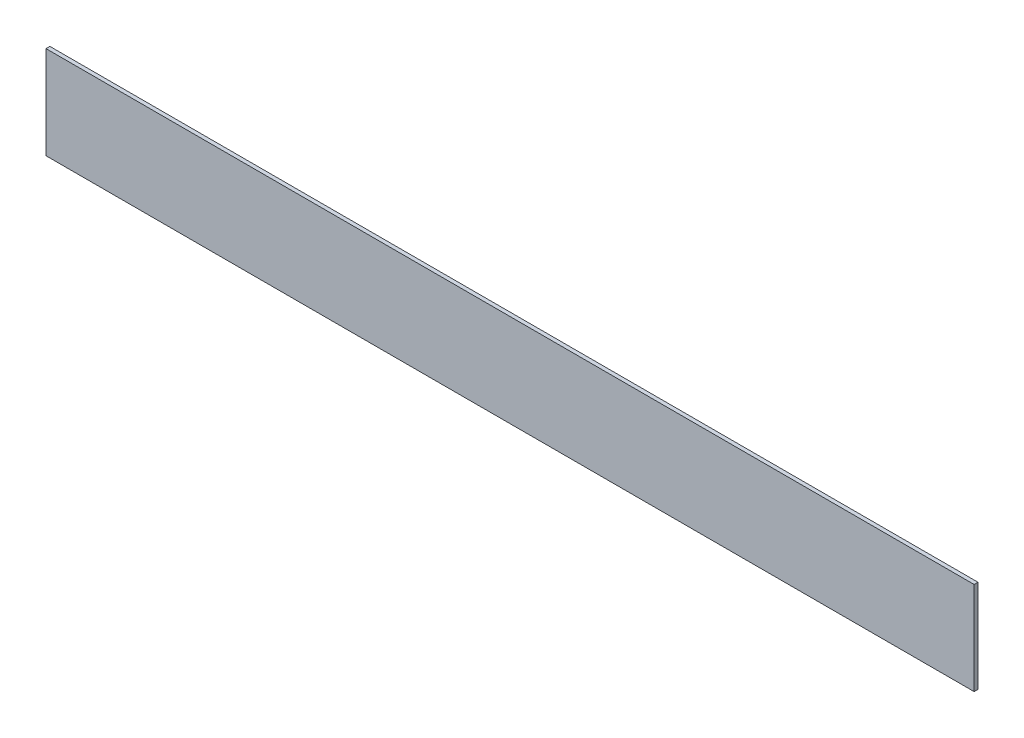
SolidWorks part; units mm, degrees
ref_plane "Front Plane" through (0, 0, 0) normal (0, 0, 1) x (1, 0, 0)
ref_plane "Top Plane" through (0, 0, 0) normal (0, 1, 0) x (1, 0, 0)
ref_plane "Right Plane" through (0, 0, 0) normal (1, 0, 0) x (0, 0, -1)
sketch "Sketch1" plane through (0, 0, 0) normal (0, 0, 1) x (1, 0, 0)
  line L1 (-95.9041, 52.5715) -> (666.0959, 52.5715)
  line L2 (-95.9041, 52.5715) -> (-95.9041, -23.6285)
  line L3 (-95.9041, -23.6285) -> (666.0959, -23.6285)
  line L4 (666.0959, 52.5715) -> (666.0959, -23.6285)
  dimension "D1" = 762
  dimension "D2" = 76.2
extrude "Extrude1" add sketch "Sketch1" along normal blind 3.175
